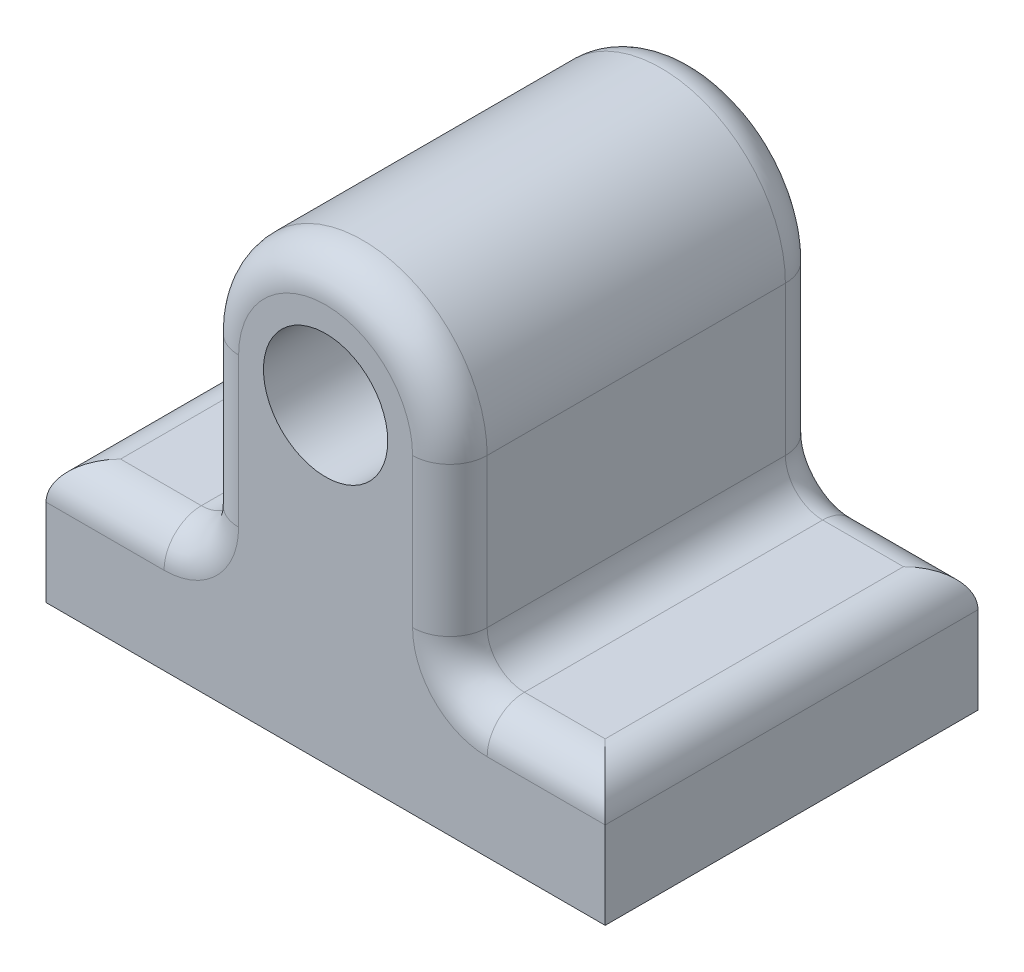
SolidWorks part; units mm, degrees
ref_plane "Front Plane" through (0, 0, 0) normal (0, 0, 1) x (1, 0, 0)
ref_plane "Top Plane" through (0, 0, 0) normal (0, 1, 0) x (1, 0, 0)
ref_plane "Right Plane" through (0, 0, 0) normal (1, 0, 0) x (0, 0, -1)
sketch "Sketch1" plane through (0, 0, 0) normal (0, 0, 1) x (1, 0, 0)
  line L0 (70, 15) -> (70, 0)
  line L1 (70, 0) -> (57.5, 0)
  line L2 (57.5, 0) -> (57.5, -10)
  line L3 (57.5, -10) -> (102.5, -10)
  line L4 (102.5, -10) -> (102.5, 0)
  line L5 (102.5, 0) -> (90, 0)
  line L6 (90, 0) -> (90, 15)
  circle A0 centre (80, 15) radius 5
  arc A1 (90, 15) -> (70, 15) centre (80, 15) ccw
  dimension "D1" = 10
  dimension "D2" = 20
  dimension "D3" = 10
  dimension "D4" = 45
  dimension "D5" = 25
extrude "Boss-Extrude1" add sketch "Sketch1" along normal blind 30
fillet "Fillet1" radius 3 14 edges at (90, 7.5, 0) (70, 7.5, 0) (90, 7.5, 30) (70, 7.5, 30) (70, 0, 15) (57.5, 0, 15) (63.75, 0, 0) (63.75, 0, 30) (102.5, 0, 15) (90, 0, 15) (96.25, 0, 30) (96.25, 0, 0) (80, 25, 0) (80, 25, 30)
